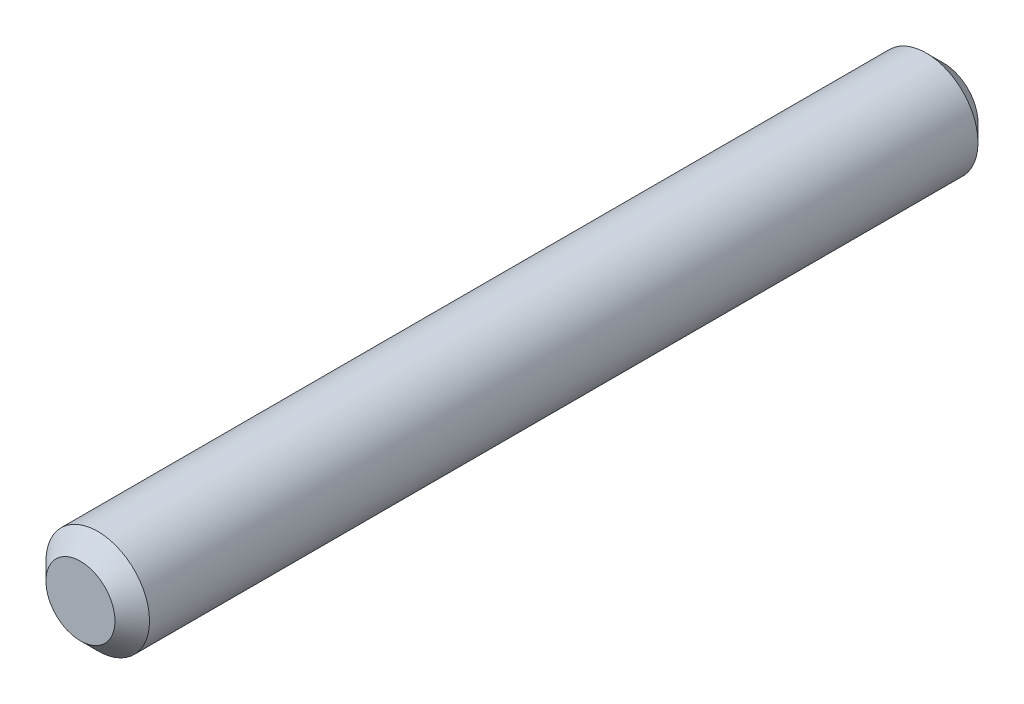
SolidWorks part; units mm, degrees
ref_plane "Plan de face" through (0, 0, 0) normal (0, 0, 1) x (1, 0, 0)
ref_plane "Plan de dessus" through (0, 0, 0) normal (0, 1, 0) x (1, 0, 0)
ref_plane "Plan de droite" through (0, 0, 0) normal (1, 0, 0) x (0, 0, -1)
sketch "Esquisse1" plane through (0, 0, 0) normal (0, 0, 1) x (1, 0, 0)
  circle A0 centre (0, 0) radius 3
extrude "Extrusion1" add sketch "Esquisse1" along normal blind 50
chamfer "Chanfrein1" distance 1 angle 45 2 edges at (3, 0, 0) (3, 0, 50)
